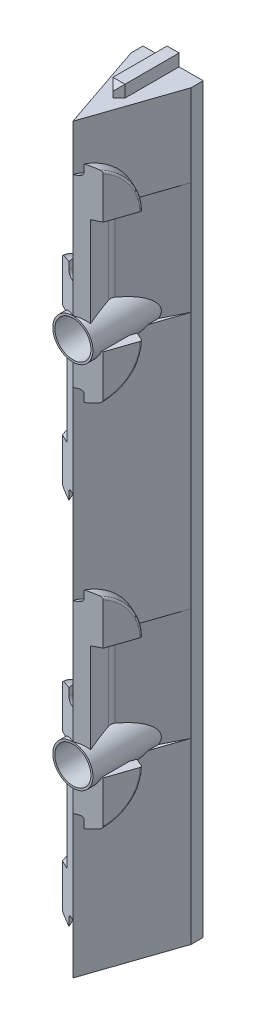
SolidWorks part; units mm, degrees
ref_plane "Plan de face" through (0, 0, 0) normal (0, 0, 1) x (1, 0, 0)
ref_plane "Plan de dessus" through (0, 0, 0) normal (0, 1, 0) x (1, 0, 0)
ref_plane "Plan de droite" through (0, 0, 0) normal (1, 0, 0) x (0, 0, -1)
body saved out of another part "Stock-basBarette-1"
sketch "Esquisse1" plane through (0, 0, -3) normal (0, 0, -1) x (-1, 0, 0)
  line L0 (7.5, -303.9983) -> (-7.5, -303.9983) construction
  line L1 (-1.5, -303.9983) -> (1.5, -303.9983)
  line L2 (-1.5, -303.9983) -> (-1.5, -300.9983)
  line L3 (-1.5, -300.9983) -> (1.5, -300.9983)
  line L4 (1.5, -303.9983) -> (1.5, -300.9983)
  line L5 (-7.5, -303.9983) -> (-7.5, -489) construction
  point P8 (0, -300.9983)
  dimension "D1" = 3
  dimension "D2" = 3
  dimension "D3" = 7.5
extrude "Boss.-Extru.1" add sketch "Esquisse1" against normal blind 15
chamfer "Chanfrein1" distance 1.5 angle 45 3 edges at (-1.5, -302.4983, 12) (0, -300.9983, 12) (1.5, -302.4983, 12)
sketch "Esquisse2" plane through (0, 0, -3) normal (0, 0, -1) x (-1, 0, 0)
  line B0 (4.7797, -340.7827) -> (4.7797, -312.733) construction
  line B1 (-1.7203, -481.2588) -> (-1.7203, -440.019) construction
sketch_block_instance "Bloc1-1"
sketch_block "Bloc1"
extrude "Enlèv. mat.-Extru.1" cut sketch "Esquisse2" against normal blind 1.5
